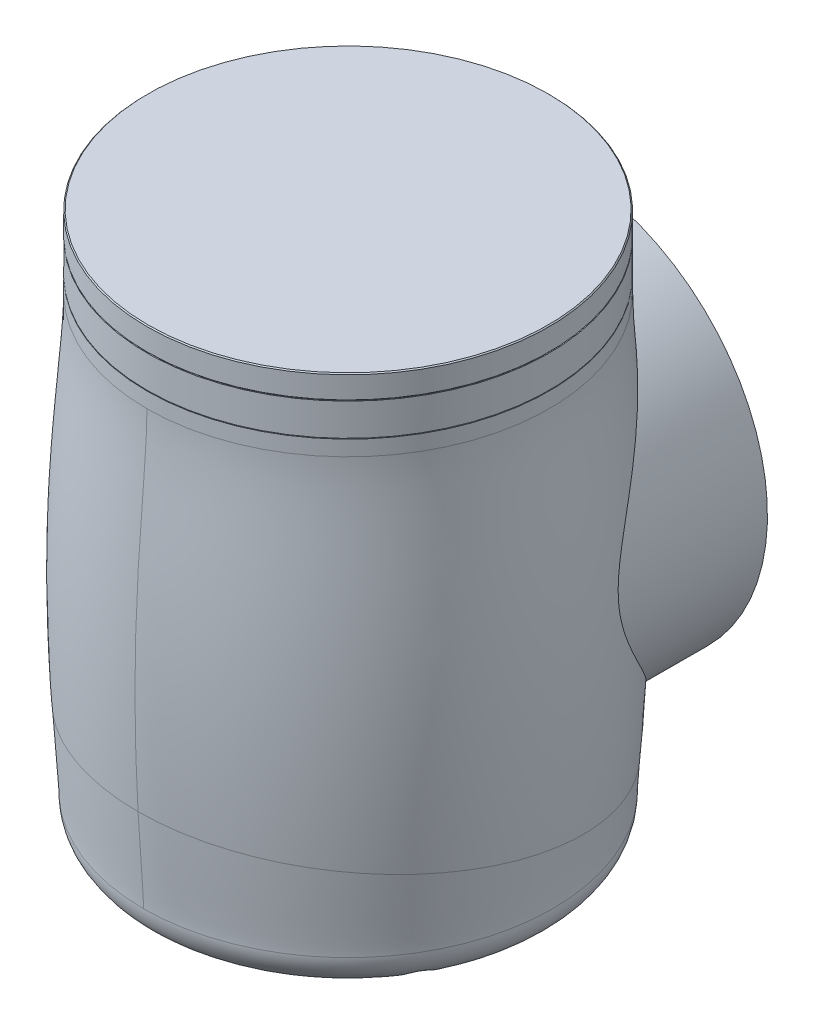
SolidWorks part; units mm, degrees
ref_plane "前视基准面" through (0, 0, 0) normal (0, 0, 1) x (1, 0, 0)
ref_plane "上视基准面" through (0, 0, 0) normal (0, 1, 0) x (1, 0, 0)
ref_plane "右视基准面" through (0, 0, 0) normal (1, 0, 0) x (0, 0, -1)
imported_body "输入1"
other "删除面1"
sketch "草图1" plane through (0, 0, 94.0983) normal (0, 0, -1) x (-1, 0, 0)
  circle A0 centre (17.446, -57.4085) radius 1
  arc A1 (17.446, 60.5915) -> (17.446, -57.4085) centre (17.446, 1.5915) ccw construction
  circle A2 centre (17.446, 1.5915) radius 59 construction
  dimension "D1" = 2
extrude "切除-拉伸1" cut sketch "草图1" against normal blind 3
ref_plane "基准面1" through (0, 65.0915, 0) normal (0, 1, 0) x (1, 0, 0)
sketch "草图2" plane through (0, 65.0915, 0) normal (0, 1, 0) x (1, 0, 0)
  circle A0 centre (-17.446, -99.3983) radius 1
  arc A1 (40.6441, -149.6586) -> (-75.5361, -166.5381) centre (-17.446, -158.0983) ccw construction
  dimension "D1" = 2
extrude "切除-拉伸2" cut sketch "草图2" against normal blind 3
